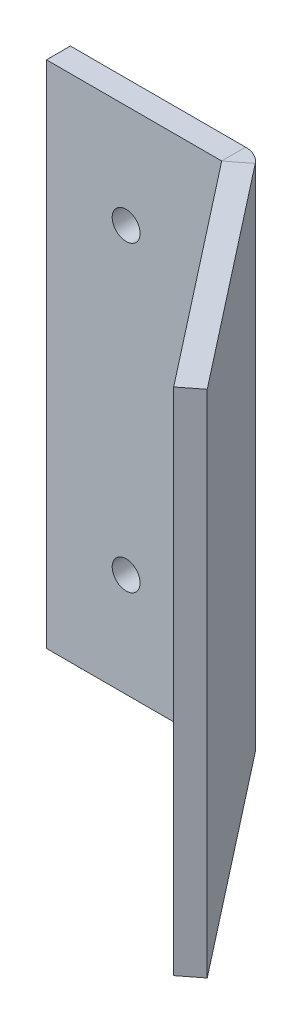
SolidWorks part; units mm, degrees
ref_plane "Front Plane" through (0, 0, 0) normal (0, 0, 1) x (1, 0, 0)
ref_plane "Top Plane" through (0, 0, 0) normal (0, 1, 0) x (1, 0, 0)
ref_plane "Right Plane" through (0, 0, 0) normal (1, 0, 0) x (0, 0, -1)
sketch "Sketch1" plane through (0, 0, 0) normal (0, 0, 1) x (1, 0, 0)
  line L0 (0, 32) -> (57, 32) construction
  line L1 (0, 0) -> (57, 0)
  line L2 (0, 0) -> (0, 64)
  line L3 (0, 64) -> (57, 64)
  line L4 (57, 0) -> (57, 64)
  line L5 (10, 51) -> (10, 13) construction
  circle A0 centre (10, 51) radius 1.75
  circle A1 centre (10, 13) radius 1.75
  dimension "D1" = 3.5
  dimension "D2" = 13
  dimension "D3" = 19
  dimension "D6" = 10
  dimension "D7" = 47
  dimension "D4" = 19
sheet metal parameters "Sheet-Metal1" thickness 3 parameters "D1"=1
base flange "Base-Flange1" sketch "Sketch1" thickness 3 reverse thickness direction yes parameters "D1"=1
sketch "Sketch3" plane through (0, 0, 3) normal (0, 0, 1) x (1, 0, 0)
  line L0 (22, 64) -> (22, 0)
  line L1 (57, 64) -> (0, 64) construction
  line L2 (0, 0) -> (57, 0) construction
  line L3 (0, 64) -> (0, 0) construction
  dimension "D1" = 22
sketched bend "Sketched Bend1" parameters "D1"=0.01
bend "SketchBend1" bend radius 0.01 bend angle 52 parameters "D5"=1
flat pattern "Flat-Pattern1"
sketch "Bend-Lines1" plane through (0, 0, 0) normal (0, 1, 0) x (-1, 0, 0)
bend of the flat pattern "Flatten-<SketchBend1>1"
